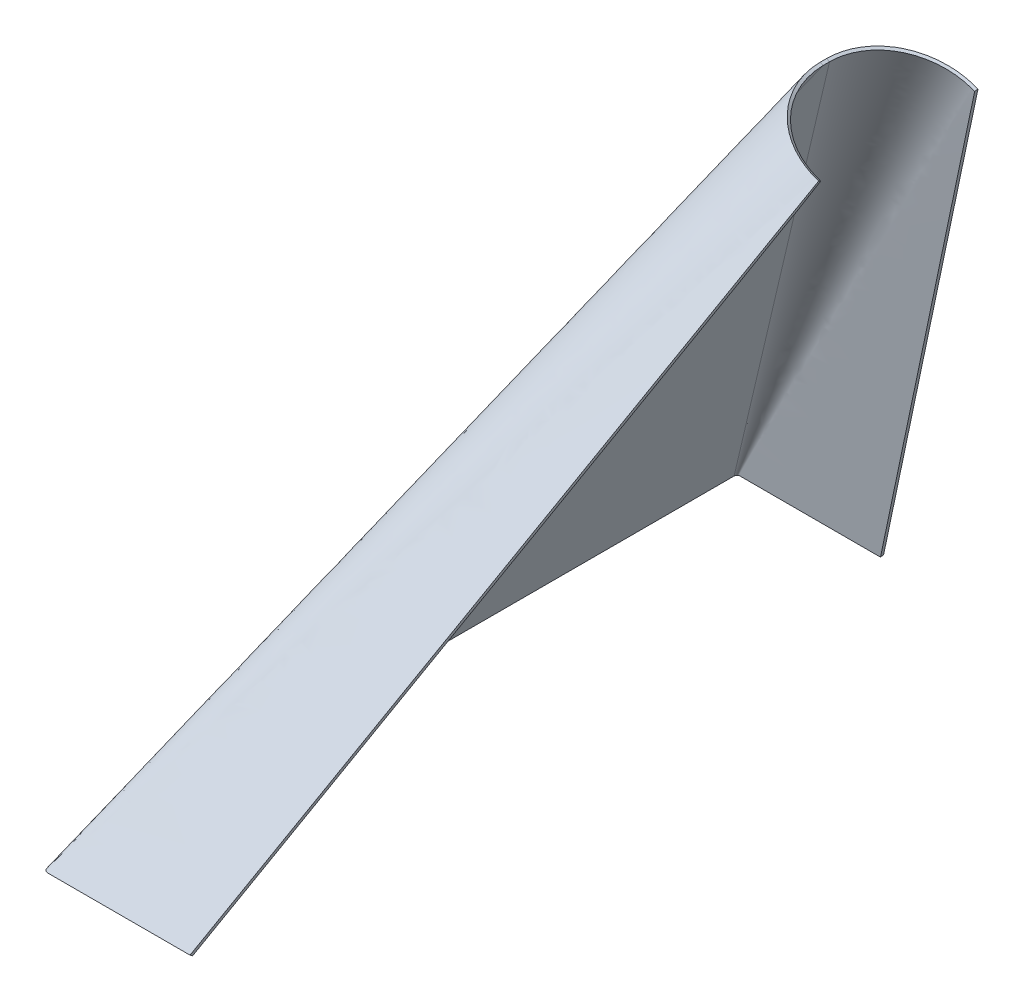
SolidWorks part; units mm, degrees
ref_plane "Ebene vorne" through (0, 0, 0) normal (0, 0, 1) x (1, 0, 0)
ref_plane "Ebene oben" through (0, 0, 0) normal (0, 1, 0) x (1, 0, 0)
ref_plane "Ebene rechts" through (0, 0, 0) normal (1, 0, 0) x (0, 0, -1)
ref_plane "Ebene1" through (0, 527, 0) normal (0, 1, 0) x (-1, 0, 0)
sketch "Skizze1" plane through (0, 527, 0) normal (0, 1, 0) x (-1, 0, 0)
  line L0 (-192, -130.4359) -> (-192, -166.5641) construction
  line L1 (-210.0641, -148.5) -> (-173.9359, -148.5) construction
  point P4 (-192, -148.5)
  dimension "D1" = 192
  dimension "D2" = 148.5
ref_plane "Ebene2" through (191.8343, 527.0603, 0) normal (0.342, 0.9397, 0) x (-0.9397, 0.342, 0)
sketch "Skizze2" plane through (0, 0, 0) normal (0, 1, 0) x (1, 0, 0)
  line L0 (0, 326.5) -> (-133.5, 326.5)
  line L1 (-138.5, 321.5) -> (-138.5, -321.5)
  line L2 (-133.5, -326.5) -> (0, -326.5)
  arc A0 (-133.5, 326.5) -> (-138.5, 321.5) centre (-133.5, 321.5) ccw
  arc A1 (-138.5, -321.5) -> (-133.5, -326.5) centre (-133.5, -321.5) ccw
  dimension "D1" = 5
  dimension "D2" = 653
  dimension "D3" = 326.5
  dimension "D4" = 138.5
  dimension "D5" = 138.5
sketch "Skizze3" plane through (372.421, 461.3321, 0) normal (-0.342, -0.9397, 0) x (0.9397, -0.342, 0)
  line L5 (-192, 50.9622) -> (-192, -47.3315) construction
  line L6 (-195.1764, -223.5) -> (-192.1764, -223.5)
  line L7 (-267.1764, -145.5) -> (-267.1764, -151.5)
  line L8 (-192.1764, -73.5) -> (-195.1764, -73.5)
  arc A2 (-267.1764, -151.5) -> (-195.1764, -223.5) centre (-195.1764, -151.5) ccw
  arc A3 (-267.1764, -145.5) -> (-195.1764, -73.5) centre (-195.1764, -145.5) cw
  dimension "D5" = 3
  dimension "D1" = 72
  dimension "D2" = 75
  dimension "D3" = 73.5
  dimension "D4" = 150
sheet metal parameters "Blech2" thickness 3 parameters "D1"=4.5, "Dicke"=3
lofted bend "Ausgeformte Biegungen2" parameters "D1"=0, "D12"=3
other "Freiform-Biegung3" parameters "D1"=1000, "D4"=57.296, "D5"=1
other "Freiform-Biegung4" parameters "D1"=1000, "D4"=57.296, "D5"=2
flat pattern "Abwicklung2"
sketch "Biegung-Linien2" plane through (0, 0, 0) normal (0, 1, 0) x (-1, 0, 0)
other "Abwickeln-<Freiform-Biegung3>1"
other "Abwickeln-<Freiform-Biegung4>1"
